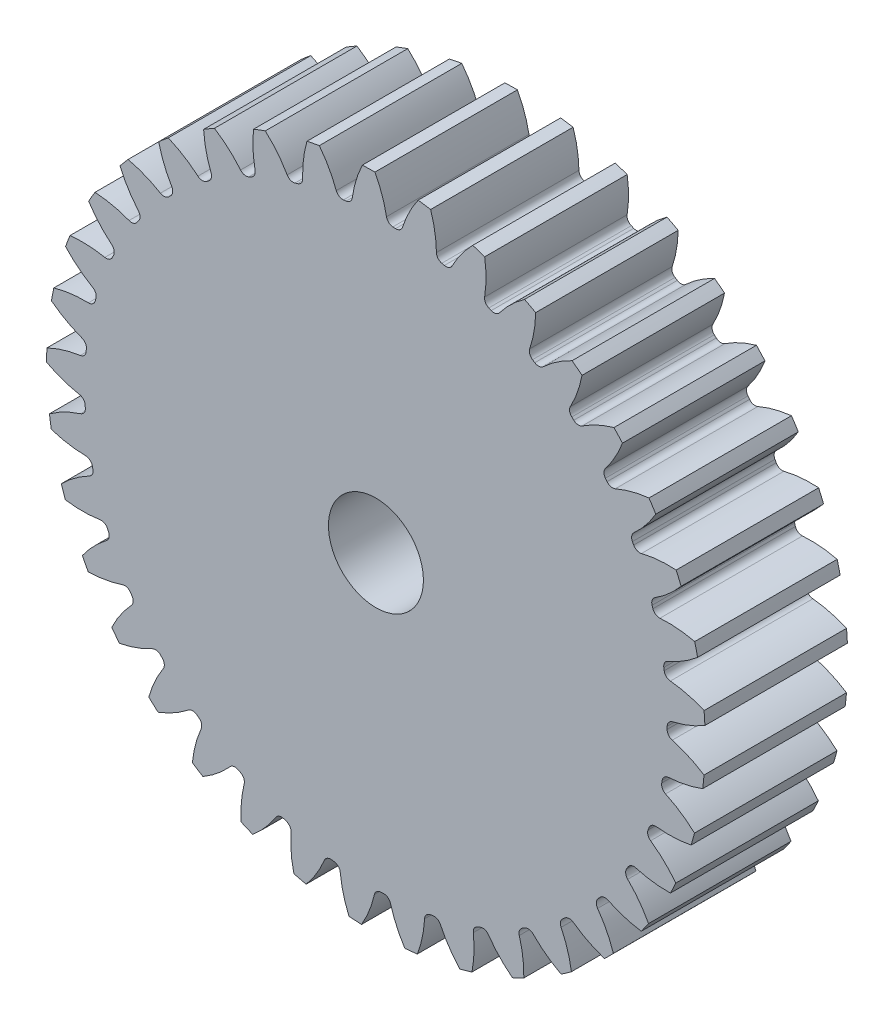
SolidWorks part; units mm, degrees
ref_plane "Front" through (0, 0, 0) normal (0, 0, 1) x (1, 0, 0)
ref_plane "Top" through (0, 0, 0) normal (0, 1, 0) x (1, 0, 0)
ref_plane "Right" through (0, 0, 0) normal (1, 0, 0) x (0, 0, -1)
sketch "Sketch3" plane through (0, 0, 0) normal (0, 0, 1) x (1, 0, 0)
  circle A0 centre (0, 0) radius 220.1333
  dimension "od" = 440.2667
extrude "gearBody" add sketch "Sketch3" along normal blind 95.25
sketch "Sketch2" plane through (0, 0, 0) normal (0, 0, 1) x (1, 0, 0)
  line L0 (0, 0) -> (181.311, 75.1015) construction
  line L1 (219.539, -19.0795) -> (0, 0) construction
  line L2 (0, 0) -> (36.3143, 0) construction
  line L3 (208.7941, 4.5863) -> (208.4349, -13.0734) construction
  line L5 (208.6145, -4.2436) -> (0, 0) construction
  line L7 (0, 0) -> (196.2496, 0) construction
  arc A0 (196.2475, 0.9084) -> (196.0482, -8.8884) centre (0, 0) ccw construction
  arc A1 (219.9061, 10.0005) -> (219.3175, -18.9351) centre (0, 0) ccw construction
  arc A2 (208.7941, 4.5863) -> (208.4349, -13.0734) centre (0, 0) ccw construction
  arc A3 (194.6727, -4.8604) -> (194.7093, -3.0603) centre (0, 0) ccw
  arc A4 (219.539, -19.0795) -> (198.0548, -9.4072) centre (178.1069, -82.4126) ccw
  arc A5 (219.539, -19.0795) -> (220.1333, 10.1358) centre (0, 0) ccw
  arc A6 (220.1333, 10.1358) -> (198.2735, 1.3452) centre (181.311, 75.1015) cw
  arc A7 (194.7093, -3.0603) -> (198.2735, 1.3452) centre (199.3033, -3.1325) cw
  arc A8 (198.0548, -9.4072) -> (194.6727, -4.8604) centre (199.2658, -4.9751) cw
  point P6 (220.1333, 10.1358)
  point P22 (219.539, -19.0795)
  dimension "baseDia" = 392.4992
  dimension "od" = 440.2667
  dimension "pd" = 417.6889
  dimension "rd" = 389.4667
  dimension "rFillet" = 4.5946
  dimension "pointX" = 220.1333
  dimension "pointY" = 10.1358
  dimension "CTT" = 17.6597
  dimension "flankCenterAngle" = 22.5
extrude "toothCut" cut sketch "Sketch2" along normal through all
pattern_circular "CirPattern1" count 37 over 360 about axis through (0, 0, 0) along (0, 0, 1) of "toothCut"
sketch "hub1Dia" plane through (0, 0, 0) normal (0, 0, -1) x (-1, 0, 0)
  circle A0 centre (0, 0) radius 12.7
  dimension "hub1Dia" = 25.4
sketch "hub2Dia" plane through (0, 0, 95.25) normal (0, 0, 1) x (1, 0, 0)
  circle A0 centre (0, 0) radius 12.7
  dimension "hub2dia" = 25.4
sketch "boreDia" plane through (0, 0, 0) normal (0, 0, 1) x (1, 0, 0)
  circle A0 centre (0, 0) radius 31.75
  dimension "boreDia" = 63.5
extrude "bore" cut sketch "boreDia" against normal mid plane 25400
